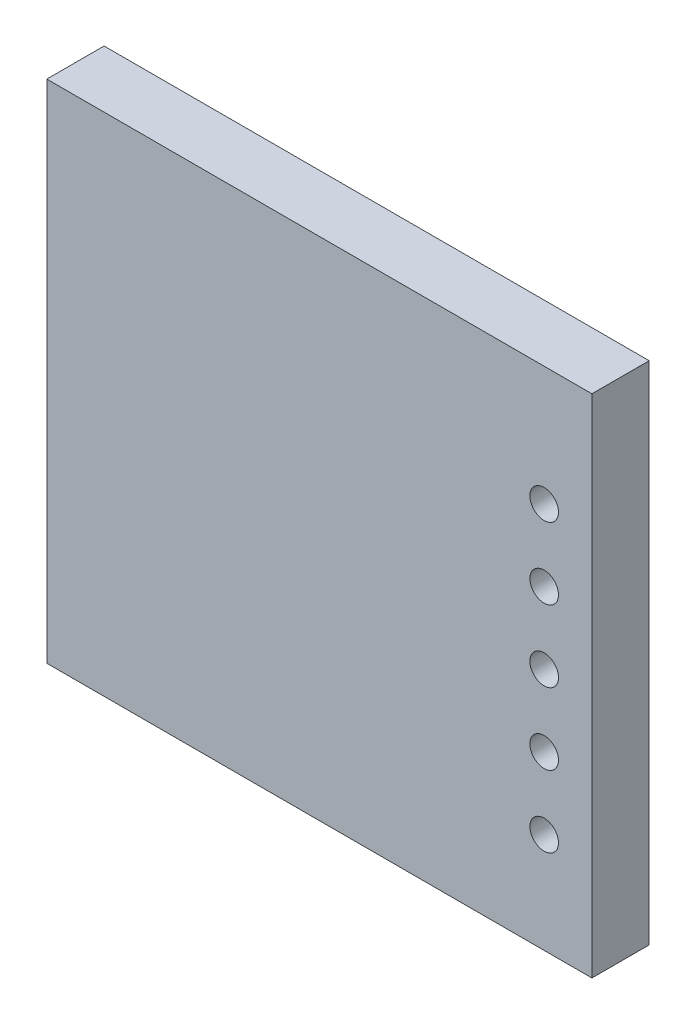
SolidWorks part; units mm, degrees
ref_plane "Front Plane" through (0, 0, 0) normal (0, 0, 1) x (1, 0, 0)
ref_plane "Top Plane" through (0, 0, 0) normal (0, 1, 0) x (1, 0, 0)
ref_plane "Right Plane" through (0, 0, 0) normal (1, 0, 0) x (0, 0, -1)
sketch "Sketch1" plane through (0, 0, 0) normal (0, 0, 1) x (1, 0, 0)
  line L1 (0, 0) -> (14.5034, 0)
  line L2 (0, 0) -> (0, 13.462)
  line L3 (0, 13.462) -> (14.5034, 13.462)
  line L4 (14.5034, 0) -> (14.5034, 13.462)
  dimension "D1" = 14.5034
  dimension "D2" = 13.462
extrude "Boss-Extrude1" add sketch "Sketch1" along normal blind 1.524
sketch "Sketch2" plane through (0, 0, 1.524) normal (0, 0, 1) x (1, 0, 0)
  line L0 (14.5034, 13.462) -> (0, 13.462) construction
  line L1 (14.5034, 0) -> (14.5034, 13.462) construction
  circle A0 centre (13.2334, 10.287) radius 0.381
  circle A1 centre (13.2334, 8.382) radius 0.381
  circle A2 centre (13.2334, 6.477) radius 0.381
  circle A3 centre (13.2334, 4.572) radius 0.381
  circle A4 centre (13.2334, 2.667) radius 0.381
  dimension "D1" = 0.762
  dimension "D2" = 0.762
  dimension "D3" = 0.762
  dimension "D4" = 0.762
  dimension "D5" = 0.762
  dimension "D13" = 1.27
  dimension "D6" = 3.175
  dimension "D7" = 1.905
  dimension "D8" = 1.905
  dimension "D9" = 1.905
  dimension "D10" = 1.905
  dimension "D11" = 1.27
  dimension "D12" = 1.27
  dimension "D14" = 1.27
  dimension "D15" = 1.27
extrude "Cut-Extrude1" cut sketch "Sketch2" against normal blind 6.096
